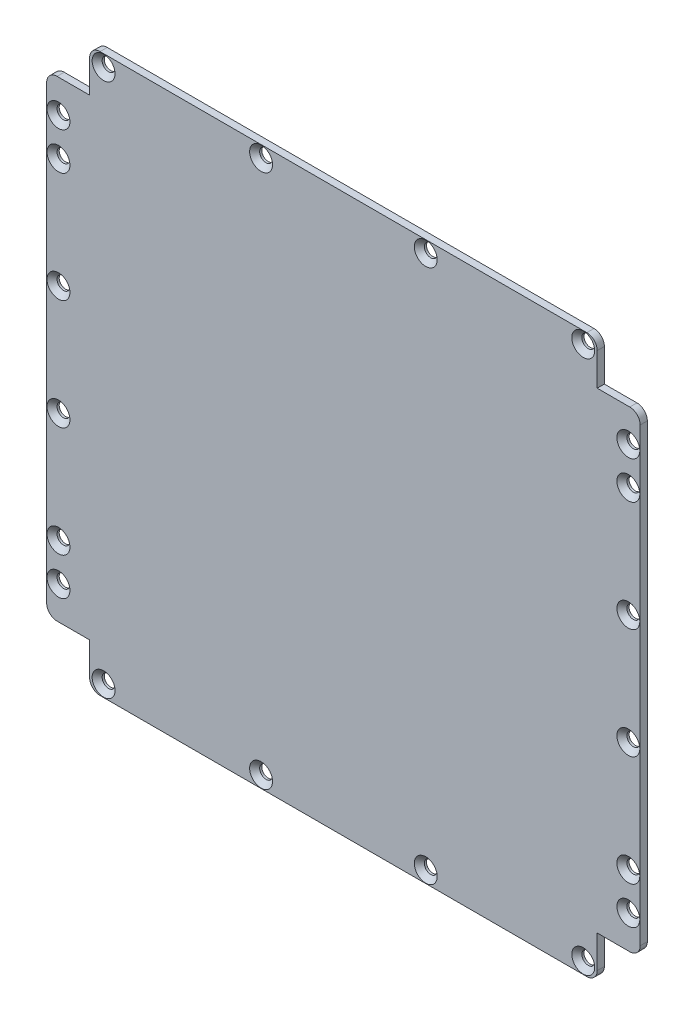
SolidWorks part; units mm, degrees
ref_plane "前视" through (0, 0, 0) normal (0, 0, 1) x (1, 0, 0)
ref_plane "上视" through (0, 0, 0) normal (0, 1, 0) x (1, 0, 0)
ref_plane "右视" through (0, 0, 0) normal (1, 0, 0) x (0, 0, -1)
sketch "草图1" plane through (0, 0, 0) normal (0, 0, 1) x (1, 0, 0)
  line L0 (100.0701, 138.3777) -> (98.0701, 138.3777)
  line L1 (98.0701, 125.6777) -> (100.0701, 125.6777)
  line L2 (98.0701, 134.1277) -> (93.0701, 134.1277)
  line L3 (93.0701, 129.9277) -> (98.0701, 129.9277)
  line L4 (187.0701, 122.3777) -> (185.0701, 122.3777)
  line L5 (185.0701, 109.6777) -> (187.0701, 109.6777)
  line L6 (187.0701, 113.9277) -> (192.0701, 113.9277)
  line L7 (192.0701, 118.1277) -> (187.0701, 118.1277)
  line L8 (100.0701, 109.3777) -> (98.0701, 109.3777)
  line L9 (98.0701, 96.6777) -> (100.0701, 96.6777)
  line L10 (98.0701, 105.1277) -> (93.0701, 105.1277)
  line L11 (93.0701, 100.9277) -> (98.0701, 100.9277)
  line L12 (187.0701, 109.3777) -> (185.0701, 109.3777)
  line L13 (185.0701, 96.6777) -> (187.0701, 96.6777)
  line L14 (187.0701, 100.9277) -> (192.0701, 100.9277)
  line L15 (192.0701, 105.1277) -> (187.0701, 105.1277)
  line L16 (187.0701, 138.3777) -> (185.0701, 138.3777)
  line L17 (185.0701, 125.6777) -> (187.0701, 125.6777)
  line L18 (187.0701, 129.9277) -> (192.0701, 129.9277)
  line L19 (192.0701, 134.1277) -> (187.0701, 134.1277)
  line L20 (172.2601, 70.7177) -> (172.2601, 75.6677)
  line L21 (158.5201, 75.6677) -> (158.5201, 70.7177)
  line L22 (98.0701, 137.7022) -> (100.0701, 137.7022)
  line L23 (98.0701, 137.7022) -> (98.0701, 138.3777)
  line L24 (100.0701, 126.3532) -> (98.0701, 126.3532)
  line L25 (98.0701, 125.6777) -> (98.0701, 126.3532)
  line L26 (98.0701, 126.3532) -> (98.0701, 137.7022)
  line L27 (93.0701, 134.1277) -> (93.0701, 129.9277)
  line L28 (185.0701, 121.7022) -> (187.0701, 121.7022)
  line L29 (187.0701, 122.3777) -> (187.0701, 121.7022)
  line L30 (187.0701, 110.3532) -> (185.0701, 110.3532)
  line L31 (187.0701, 121.7022) -> (187.0701, 110.3532)
  line L32 (187.0701, 110.3532) -> (187.0701, 109.6777)
  line L33 (192.0701, 116.0277) -> (192.0701, 118.1277)
  line L34 (192.0701, 113.9277) -> (192.0701, 116.0277)
  line L35 (100.0701, 97.3532) -> (98.0701, 97.3532)
  line L36 (98.0701, 97.3532) -> (98.0701, 108.7022)
  line L37 (98.0701, 108.7022) -> (100.0701, 108.7022)
  line L38 (98.0701, 108.7022) -> (98.0701, 109.3777)
  line L39 (98.0701, 96.6777) -> (98.0701, 97.3532)
  line L40 (93.0701, 105.1277) -> (93.0701, 100.9277)
  line L41 (185.0701, 108.7022) -> (187.0701, 108.7022)
  line L42 (187.0701, 108.7022) -> (187.0701, 97.3532)
  line L43 (187.0701, 97.3532) -> (185.0701, 97.3532)
  line L44 (187.0701, 109.3777) -> (187.0701, 108.7022)
  line L45 (187.0701, 97.3532) -> (187.0701, 96.6777)
  line L46 (192.0701, 103.0277) -> (192.0701, 105.1277)
  line L47 (192.0701, 100.9277) -> (192.0701, 103.0277)
  line L48 (185.0701, 137.7022) -> (187.0701, 137.7022)
  line L49 (187.0701, 138.3777) -> (187.0701, 137.7022)
  line L50 (187.0701, 126.3532) -> (185.0701, 126.3532)
  line L51 (187.0701, 126.3532) -> (187.0701, 125.6777)
  line L52 (187.0701, 137.7022) -> (187.0701, 126.3532)
  line L53 (192.0701, 132.0277) -> (192.0701, 134.1277)
  line L54 (192.0701, 129.9277) -> (192.0701, 132.0277)
  line L55 (155.7101, 75.6677) -> (175.0701, 75.6677)
  line L56 (155.7101, 75.6677) -> (155.7101, 78.0277)
  line L57 (175.0701, 78.0277) -> (175.0701, 75.6677)
  line L58 (153.7101, 78.0277) -> (153.7101, 75.6677)
  line L59 (153.7101, 75.6677) -> (155.7101, 75.6677)
  line L60 (177.0701, 75.6677) -> (177.0701, 78.0277)
  line L61 (175.0701, 75.6677) -> (177.0701, 75.6677)
  line L62 (169.7601, 70.7177) -> (172.2601, 70.7177)
  line L63 (169.7601, 75.6677) -> (169.7601, 70.7177)
  line L64 (161.0201, 70.7177) -> (161.0201, 75.6677)
  line L65 (158.5201, 70.7177) -> (161.0201, 70.7177)
  line L66 (169.7601, 70.7177) -> (161.0201, 70.7177)
  line L67 (155.3001, 71.2542) -> (155.3001, 75.6677)
  line L68 (157.3201, 71.2542) -> (157.3201, 75.6677)
  line L69 (154.2901, 71.7677) -> (154.5354, 71.7677)
  line L70 (154.2901, 75.6677) -> (154.2901, 71.7677)
  line L71 (154.5354, 70.9754) -> (154.7951, 70.8677)
  line L72 (154.5354, 71.7677) -> (154.5354, 70.9754)
  line L73 (157.8251, 70.8677) -> (158.0847, 70.9754)
  line L74 (158.3301, 71.7677) -> (158.3301, 75.6677)
  line L75 (158.0847, 71.7677) -> (158.3301, 71.7677)
  line L76 (158.0847, 70.9754) -> (158.0847, 71.7677)
  line L77 (157.8251, 70.8677) -> (156.3101, 70.8677)
  line L78 (156.3101, 70.8677) -> (154.7951, 70.8677)
  line L79 (158.007, 70.8677) -> (158.0847, 70.9754)
  line L80 (157.8251, 70.8677) -> (158.007, 70.8677)
  line L81 (154.5354, 70.9754) -> (154.6131, 70.8677)
  line L82 (154.6131, 70.8677) -> (154.7951, 70.8677)
  line L83 (172.4501, 71.7677) -> (172.6954, 71.7677)
  line L84 (172.4501, 75.6677) -> (172.4501, 71.7677)
  line L85 (173.4601, 71.2542) -> (173.4601, 75.6677)
  line L86 (172.6954, 70.9754) -> (172.9551, 70.8677)
  line L87 (172.6954, 71.7677) -> (172.6954, 70.9754)
  line L88 (175.9851, 70.8677) -> (176.2447, 70.9754)
  line L89 (175.4801, 71.2542) -> (175.4801, 75.6677)
  line L90 (176.4901, 71.7677) -> (176.4901, 75.6677)
  line L91 (176.2447, 71.7677) -> (176.4901, 71.7677)
  line L92 (176.2447, 70.9754) -> (176.2447, 71.7677)
  line L93 (175.9851, 70.8677) -> (174.4701, 70.8677)
  line L94 (174.4701, 70.8677) -> (172.9551, 70.8677)
  line L95 (176.167, 70.8677) -> (176.2447, 70.9754)
  line L96 (175.9851, 70.8677) -> (176.167, 70.8677)
  line L97 (172.6954, 70.9754) -> (172.7731, 70.8677)
  line L98 (172.7731, 70.8677) -> (172.9551, 70.8677)
  line L99 (179.0701, 158.0277) -> (106.0701, 158.0277)
  line L100 (100.0701, 152.0277) -> (100.0701, 84.0277)
  line L101 (185.0701, 84.0277) -> (181.5701, 84.0277)
  line L102 (106.0701, 78.0277) -> (179.0701, 78.0277)
  line L103 (106.0701, 78.0277) -> (106.0701, 81.5277)
  line L104 (181.5701, 152.0277) -> (185.0701, 152.0277)
  line L105 (179.0701, 78.0277) -> (179.0701, 81.5277)
  line L106 (100.0701, 152.0277) -> (103.5701, 152.0277)
  line L107 (185.0701, 84.0277) -> (185.0701, 152.0277)
  line L108 (103.5701, 84.0277) -> (100.0701, 84.0277)
  line L109 (106.0701, 154.5277) -> (106.0701, 158.0277)
  line L110 (179.0701, 158.0277) -> (179.0701, 154.5277)
  line L111 (185.0701, 158.0277) -> (179.0701, 158.0277)
  line L112 (185.0701, 152.0277) -> (185.0701, 158.0277)
  line L113 (179.0701, 78.0277) -> (185.0701, 78.0277)
  line L114 (185.0701, 78.0277) -> (185.0701, 84.0277)
  line L115 (100.0701, 84.0277) -> (100.0701, 78.0277)
  line L116 (100.0701, 78.0277) -> (106.0701, 78.0277)
  line L117 (106.0701, 158.0277) -> (100.0701, 158.0277)
  line L118 (100.0701, 158.0277) -> (100.0701, 152.0277)
  line L119 (47.0263, 121.7022) -> (47.0263, 110.3532)
  line L120 (52.7263, 110.3532) -> (52.7263, 121.7022)
  line L121 (47.0263, 108.7022) -> (47.0263, 97.3532)
  line L122 (52.7263, 97.3532) -> (52.7263, 108.7022)
  line L123 (47.0263, 137.7022) -> (47.0263, 126.3532)
  line L124 (52.7263, 126.3532) -> (52.7263, 137.7022)
  line L125 (55.7763, 75.6677) -> (55.7763, 78.0277)
  line L126 (53.7763, 75.6677) -> (55.7763, 75.6677)
  line L127 (53.7763, 78.0277) -> (53.7763, 75.6677)
  line L128 (50.1763, 75.6677) -> (50.1763, 78.0277)
  line L129 (50.1763, 75.6677) -> (53.7763, 75.6677)
  line L130 (48.1763, 78.0277) -> (48.1763, 75.6677)
  line L131 (48.1763, 75.6677) -> (50.1763, 75.6677)
  line L132 (48.8763, 75.6677) -> (48.8763, 70.7177)
  line L133 (48.8763, 70.7177) -> (52.6263, 70.7177)
  line L134 (53.8263, 75.6677) -> (53.8263, 70.7177)
  line L135 (52.6263, 70.7177) -> (53.8263, 70.7177)
  line L136 (55.0763, 70.7177) -> (55.0763, 75.6677)
  line L137 (53.8263, 70.7177) -> (55.0763, 70.7177)
  line L138 (51.9763, 71.7677) -> (52.4013, 71.7677)
  line L139 (51.9763, 71.7677) -> (51.9763, 75.6677)
  line L140 (53.7256, 71.2542) -> (53.7256, 75.6677)
  line L141 (52.4013, 70.9754) -> (52.851, 70.8677)
  line L142 (52.4013, 71.7677) -> (52.4013, 70.9754)
  line L143 (51.1016, 70.8677) -> (51.5513, 70.9754)
  line L144 (50.2269, 71.2542) -> (50.2269, 75.6677)
  line L145 (51.5513, 71.7677) -> (51.9763, 71.7677)
  line L146 (51.5513, 70.9754) -> (51.5513, 71.7677)
  line L147 (51.1016, 70.8677) -> (51.5513, 70.8677)
  line L148 (51.5513, 70.8677) -> (51.5513, 70.9754)
  line L149 (52.851, 70.8677) -> (52.4013, 70.8677)
  line L150 (52.4013, 70.9754) -> (52.4013, 70.8677)
  line L151 (53.7256, 70.8677) -> (52.851, 70.8677)
  line L152 (51.1016, 70.8677) -> (50.2269, 70.8677)
  line L153 (60.1763, 152.0277) -> (60.1763, 158.0277)
  line L154 (60.1763, 158.0277) -> (64.1763, 158.0277)
  line L155 (64.1763, 158.0277) -> (64.1763, 78.0277)
  line L156 (60.1763, 78.0277) -> (64.1763, 78.0277)
  line L157 (60.1763, 78.0277) -> (60.1763, 84.0277)
  line L158 (60.1763, 84.0277) -> (45.1763, 84.0277)
  line L159 (45.1763, 84.0277) -> (45.1763, 152.0277)
  line L160 (45.1763, 152.0277) -> (60.1763, 152.0277)
  line L161 (45.1763, 81.5277) -> (60.1763, 81.5277)
  line L162 (45.1763, 84.0277) -> (45.1763, 81.5277)
  line L163 (60.1763, 154.5277) -> (45.1763, 154.5277)
  line L164 (45.1763, 154.5277) -> (45.1763, 152.0277)
  line L165 (45.1763, 158.0277) -> (45.1763, 154.5277)
  line L166 (60.1763, 158.0277) -> (45.1763, 158.0277)
  line L167 (45.1763, 78.0277) -> (45.1763, 81.5277)
  line L168 (45.1763, 78.0277) -> (60.1763, 78.0277)
  line L169 (52.6263, 70.7177) -> (52.6263, 70.8677)
  line L170 (245.9633, 126.3532) -> (245.9633, 137.7022)
  line L171 (240.2633, 137.7022) -> (240.2633, 126.3532)
  line L172 (240.2633, 108.7022) -> (240.2633, 97.3532)
  line L173 (245.9633, 97.3532) -> (245.9633, 108.7022)
  line L174 (239.2133, 75.6677) -> (239.2133, 78.0277)
  line L175 (237.2133, 75.6677) -> (239.2133, 75.6677)
  line L176 (237.2133, 78.0277) -> (237.2133, 75.6677)
  line L177 (242.8133, 78.0277) -> (242.8133, 75.6677)
  line L178 (239.2133, 75.6677) -> (242.8133, 75.6677)
  line L179 (244.8133, 75.6677) -> (244.8133, 78.0277)
  line L180 (242.8133, 75.6677) -> (244.8133, 75.6677)
  line L181 (244.1133, 70.7177) -> (244.1133, 75.6677)
  line L182 (240.3633, 70.7177) -> (244.1133, 70.7177)
  line L183 (239.1633, 70.7177) -> (239.1633, 75.6677)
  line L184 (239.1633, 70.7177) -> (240.3633, 70.7177)
  line L185 (237.9133, 75.6677) -> (237.9133, 70.7177)
  line L186 (237.9133, 70.7177) -> (239.1633, 70.7177)
  line L187 (240.1386, 70.8677) -> (240.5883, 70.9754)
  line L188 (239.2639, 71.2542) -> (239.2639, 75.6677)
  line L189 (241.0133, 75.6677) -> (241.0133, 71.7677)
  line L190 (240.5883, 71.7677) -> (241.0133, 71.7677)
  line L191 (240.5883, 70.9754) -> (240.5883, 71.7677)
  line L192 (242.7626, 71.2542) -> (242.7626, 75.6677)
  line L193 (241.4383, 70.9754) -> (241.8879, 70.8677)
  line L194 (241.4383, 71.7677) -> (241.4383, 70.9754)
  line L195 (241.0133, 71.7677) -> (241.4383, 71.7677)
  line L196 (240.1386, 70.8677) -> (240.5883, 70.8677)
  line L197 (240.5883, 70.8677) -> (240.5883, 70.9754)
  line L198 (241.4383, 70.8677) -> (241.8879, 70.8677)
  line L199 (241.4383, 70.9754) -> (241.4383, 70.8677)
  line L200 (239.2639, 70.8677) -> (240.1386, 70.8677)
  line L201 (242.7626, 70.8677) -> (241.8879, 70.8677)
  line L202 (232.8133, 84.0277) -> (232.8133, 78.0277)
  line L203 (228.8133, 78.0277) -> (232.8133, 78.0277)
  line L204 (228.8133, 78.0277) -> (228.8133, 158.0277)
  line L205 (232.8133, 158.0277) -> (228.8133, 158.0277)
  line L206 (232.8133, 158.0277) -> (232.8133, 152.0277)
  line L207 (232.8133, 152.0277) -> (247.8133, 152.0277)
  line L208 (247.8133, 152.0277) -> (247.8133, 84.0277)
  line L209 (247.8133, 84.0277) -> (232.8133, 84.0277)
  line L210 (247.8133, 154.5277) -> (232.8133, 154.5277)
  line L211 (247.8133, 152.0277) -> (247.8133, 154.5277)
  line L212 (232.8133, 81.5277) -> (247.8133, 81.5277)
  line L213 (247.8133, 81.5277) -> (247.8133, 84.0277)
  line L214 (247.8133, 154.5277) -> (247.8133, 158.0277)
  line L215 (247.8133, 158.0277) -> (232.8133, 158.0277)
  line L216 (247.8133, 78.0277) -> (247.8133, 81.5277)
  line L217 (232.8133, 78.0277) -> (247.8133, 78.0277)
  line L218 (240.3633, 70.8677) -> (240.3633, 70.7177)
  line L219 (98.0701, 192.1775) -> (93.0701, 192.1775)
  line L220 (93.0701, 187.9775) -> (98.0701, 187.9775)
  line L221 (187.0701, 187.9775) -> (192.0701, 187.9775)
  line L222 (192.0701, 192.1775) -> (187.0701, 192.1775)
  line L223 (100.0701, 192.9275) -> (98.0701, 192.9275)
  line L224 (98.0701, 187.2275) -> (100.0701, 187.2275)
  line L225 (98.0701, 187.2275) -> (98.0701, 192.9275)
  line L226 (93.0701, 192.1775) -> (93.0701, 187.9775)
  line L227 (185.0701, 187.2275) -> (187.0701, 187.2275)
  line L228 (187.0701, 192.9275) -> (185.0701, 192.9275)
  line L229 (187.0701, 192.9275) -> (187.0701, 187.2275)
  line L230 (192.0701, 187.9775) -> (192.0701, 192.1775)
  line L231 (169.7601, 191.0775) -> (161.0201, 191.0775)
  line L232 (169.7601, 190.5775) -> (161.0201, 190.5775)
  line L233 (159.288, 187.5775) -> (159.9808, 186.3775)
  line L234 (161.7129, 185.3775) -> (169.0673, 185.3775)
  line L235 (170.7993, 186.3775) -> (171.4921, 187.5775)
  line L236 (171.9251, 187.3275) -> (171.2323, 186.1275)
  line L237 (159.5478, 186.1275) -> (158.855, 187.3275)
  line L238 (161.7129, 184.8775) -> (169.0673, 184.8775)
  line L239 (153.7101, 186.1775) -> (153.7101, 189.7775)
  line L240 (155.7101, 191.7775) -> (175.0701, 191.7775)
  line L241 (177.0701, 189.7775) -> (177.0701, 186.1775)
  line L242 (175.0701, 184.1775) -> (155.7101, 184.1775)
  line L243 (158.007, 188.4025) -> (158.0847, 188.4025)
  line L244 (157.8251, 188.8522) -> (158.0847, 188.4025)
  line L245 (154.6131, 187.5525) -> (154.5354, 187.5525)
  line L246 (154.7951, 187.1028) -> (154.5354, 187.5525)
  line L247 (158.007, 187.5525) -> (156.9878, 187.5525)
  line L248 (155.6323, 187.5525) -> (154.6131, 187.5525)
  line L249 (156.9878, 188.4025) -> (158.007, 188.4025)
  line L250 (154.6131, 188.4025) -> (155.6323, 188.4025)
  line L251 (154.5354, 188.4025) -> (154.6131, 188.4025)
  line L252 (154.5354, 188.4025) -> (154.7951, 188.8522)
  line L253 (158.0847, 187.5525) -> (158.007, 187.5525)
  line L254 (158.0847, 187.5525) -> (157.8251, 187.1028)
  line L255 (158.3301, 187.9775) -> (158.0847, 187.5525)
  line L256 (158.0847, 188.4025) -> (158.3301, 187.9775)
  line L257 (154.2901, 187.9775) -> (154.5354, 188.4025)
  line L258 (154.5354, 187.5525) -> (154.2901, 187.9775)
  line L259 (176.167, 188.4025) -> (176.2447, 188.4025)
  line L260 (175.9851, 188.8522) -> (176.2447, 188.4025)
  line L261 (172.7731, 187.5525) -> (172.6954, 187.5525)
  line L262 (172.9551, 187.1028) -> (172.6954, 187.5525)
  line L263 (176.167, 187.5525) -> (175.1478, 187.5525)
  line L264 (173.7923, 187.5525) -> (172.7731, 187.5525)
  line L265 (175.1478, 188.4025) -> (176.167, 188.4025)
  line L266 (172.7731, 188.4025) -> (173.7923, 188.4025)
  line L267 (172.6954, 188.4025) -> (172.7731, 188.4025)
  line L268 (172.6954, 188.4025) -> (172.9551, 188.8522)
  line L269 (176.2447, 187.5525) -> (176.167, 187.5525)
  line L270 (176.2447, 187.5525) -> (175.9851, 187.1028)
  line L271 (176.4901, 187.9775) -> (176.2447, 187.5525)
  line L272 (176.2447, 188.4025) -> (176.4901, 187.9775)
  line L273 (172.4501, 187.9775) -> (172.6954, 188.4025)
  line L274 (172.6954, 187.5525) -> (172.4501, 187.9775)
  line L275 (179.0701, 179.7775) -> (185.0701, 179.7775)
  line L276 (185.0701, 179.7775) -> (185.0701, 175.7775)
  line L277 (185.0701, 175.7775) -> (100.0701, 175.7775)
  line L278 (100.0701, 175.7775) -> (100.0701, 179.7775)
  line L279 (100.0701, 179.7775) -> (106.0701, 179.7775)
  line L280 (106.0701, 179.7775) -> (106.0701, 194.7775)
  line L281 (106.0701, 194.7775) -> (179.0701, 194.7775)
  line L282 (179.0701, 194.7775) -> (179.0701, 179.7775)
  line L283 (103.5701, 194.7775) -> (103.5701, 179.7775)
  line L284 (106.0701, 194.7775) -> (103.5701, 194.7775)
  line L285 (181.5701, 179.7775) -> (181.5701, 194.7775)
  line L286 (181.5701, 194.7775) -> (179.0701, 194.7775)
  line L287 (103.5701, 194.7775) -> (100.0701, 194.7775)
  line L288 (100.0701, 194.7775) -> (100.0701, 179.7775)
  line L289 (185.0701, 194.7775) -> (181.5701, 194.7775)
  line L290 (185.0701, 179.7775) -> (185.0701, 194.7775)
  line L291 (98.0701, 38.4347) -> (93.0701, 38.4347)
  line L292 (93.0701, 34.2347) -> (98.0701, 34.2347)
  line L293 (187.0701, 34.2347) -> (192.0701, 34.2347)
  line L294 (192.0701, 38.4347) -> (187.0701, 38.4347)
  line L295 (100.0701, 39.1847) -> (98.0701, 39.1847)
  line L296 (98.0701, 33.4847) -> (100.0701, 33.4847)
  line L297 (98.0701, 33.4847) -> (98.0701, 39.1847)
  line L298 (93.0701, 38.4347) -> (93.0701, 34.2347)
  line L299 (185.0701, 33.4847) -> (187.0701, 33.4847)
  line L300 (187.0701, 39.1847) -> (185.0701, 39.1847)
  line L301 (187.0701, 39.1847) -> (187.0701, 33.4847)
  line L302 (192.0701, 34.2347) -> (192.0701, 38.4347)
  line L303 (179.0701, 31.6347) -> (106.0701, 31.6347)
  line L304 (106.0701, 31.6347) -> (106.0701, 46.6347)
  line L305 (106.0701, 46.6347) -> (100.0701, 46.6347)
  line L306 (100.0701, 46.6347) -> (100.0701, 50.6347)
  line L307 (100.0701, 50.6347) -> (185.0701, 50.6347)
  line L308 (185.0701, 46.6347) -> (185.0701, 50.6347)
  line L309 (185.0701, 46.6347) -> (179.0701, 46.6347)
  line L310 (179.0701, 46.6347) -> (179.0701, 31.6347)
  line L311 (181.5701, 31.6347) -> (181.5701, 46.6347)
  line L312 (179.0701, 31.6347) -> (181.5701, 31.6347)
  line L313 (103.5701, 46.6347) -> (103.5701, 31.6347)
  line L314 (103.5701, 31.6347) -> (106.0701, 31.6347)
  line L315 (181.5701, 31.6347) -> (185.0701, 31.6347)
  line L316 (185.0701, 31.6347) -> (185.0701, 46.6347)
  line L317 (100.0701, 31.6347) -> (103.5701, 31.6347)
  line L318 (100.0701, 46.6347) -> (100.0701, 31.6347)
  line L319 (362.8161, 138.3777) -> (360.8161, 138.3777)
  line L320 (360.8161, 125.6777) -> (362.8161, 125.6777)
  line L321 (362.8161, 129.9277) -> (367.8161, 129.9277)
  line L322 (367.8161, 134.1277) -> (362.8161, 134.1277)
  line L323 (275.8161, 122.3777) -> (273.8161, 122.3777)
  line L324 (273.8161, 109.6777) -> (275.8161, 109.6777)
  line L325 (273.8161, 118.1277) -> (268.8161, 118.1277)
  line L326 (268.8161, 113.9277) -> (273.8161, 113.9277)
  line L327 (362.8161, 109.3777) -> (360.8161, 109.3777)
  line L328 (360.8161, 96.6777) -> (362.8161, 96.6777)
  line L329 (362.8161, 100.9277) -> (367.8161, 100.9277)
  line L330 (367.8161, 105.1277) -> (362.8161, 105.1277)
  line L331 (275.8161, 109.3777) -> (273.8161, 109.3777)
  line L332 (273.8161, 96.6777) -> (275.8161, 96.6777)
  line L333 (273.8161, 105.1277) -> (268.8161, 105.1277)
  line L334 (268.8161, 100.9277) -> (273.8161, 100.9277)
  line L335 (273.8161, 125.6777) -> (275.8161, 125.6777)
  line L336 (275.8161, 138.3777) -> (273.8161, 138.3777)
  line L337 (273.8161, 134.1277) -> (268.8161, 134.1277)
  line L338 (268.8161, 129.9277) -> (273.8161, 129.9277)
  line L339 (302.3661, 70.7177) -> (302.3661, 75.6677)
  line L340 (288.6261, 75.6677) -> (288.6261, 70.7177)
  line L341 (360.8161, 137.7022) -> (362.8161, 137.7022)
  line L342 (362.8161, 138.3777) -> (362.8161, 137.7022)
  line L343 (362.8161, 126.3532) -> (360.8161, 126.3532)
  line L344 (362.8161, 137.7022) -> (362.8161, 126.3532)
  line L345 (362.8161, 126.3532) -> (362.8161, 125.6777)
  line L346 (367.8161, 132.0277) -> (367.8161, 134.1277)
  line L347 (367.8161, 129.9277) -> (367.8161, 132.0277)
  line L348 (273.8161, 121.7022) -> (275.8161, 121.7022)
  line L349 (273.8161, 121.7022) -> (273.8161, 122.3777)
  line L350 (275.8161, 110.3532) -> (273.8161, 110.3532)
  line L351 (273.8161, 109.6777) -> (273.8161, 110.3532)
  line L352 (273.8161, 110.3532) -> (273.8161, 121.7022)
  line L353 (268.8161, 118.1277) -> (268.8161, 113.9277)
  line L354 (360.8161, 108.7022) -> (362.8161, 108.7022)
  line L355 (362.8161, 109.3777) -> (362.8161, 108.7022)
  line L356 (362.8161, 97.3532) -> (360.8161, 97.3532)
  line L357 (362.8161, 108.7022) -> (362.8161, 97.3532)
  line L358 (362.8161, 97.3532) -> (362.8161, 96.6777)
  line L359 (367.8161, 103.0277) -> (367.8161, 105.1277)
  line L360 (367.8161, 100.9277) -> (367.8161, 103.0277)
  line L361 (273.8161, 108.7022) -> (275.8161, 108.7022)
  line L362 (273.8161, 108.7022) -> (273.8161, 109.3777)
  line L363 (275.8161, 97.3532) -> (273.8161, 97.3532)
  line L364 (273.8161, 97.3532) -> (273.8161, 108.7022)
  line L365 (273.8161, 96.6777) -> (273.8161, 97.3532)
  line L366 (268.8161, 105.1277) -> (268.8161, 100.9277)
  line L367 (275.8161, 126.3532) -> (273.8161, 126.3532)
  line L368 (273.8161, 125.6777) -> (273.8161, 126.3532)
  line L369 (273.8161, 137.7022) -> (275.8161, 137.7022)
  line L370 (273.8161, 137.7022) -> (273.8161, 138.3777)
  line L371 (273.8161, 126.3532) -> (273.8161, 137.7022)
  line L372 (268.8161, 134.1277) -> (268.8161, 129.9277)
  line L373 (285.8161, 75.6677) -> (285.8161, 78.0277)
  line L374 (305.1761, 78.0277) -> (305.1761, 75.6677)
  line L375 (285.8161, 75.6677) -> (305.1761, 75.6677)
  line L376 (283.8161, 78.0277) -> (283.8161, 75.6677)
  line L377 (283.8161, 75.6677) -> (285.8161, 75.6677)
  line L378 (307.1761, 75.6677) -> (307.1761, 78.0277)
  line L379 (305.1761, 75.6677) -> (307.1761, 75.6677)
  line L380 (291.8189, 70.7177) -> (291.8189, 75.6677)
  line L381 (299.1733, 75.6677) -> (299.1733, 70.7177)
  line L382 (299.1733, 70.7177) -> (291.8189, 70.7177)
  line L383 (301.3384, 70.7177) -> (301.3384, 75.6677)
  line L384 (299.1733, 70.7177) -> (301.3384, 70.7177)
  line L385 (289.6539, 75.6677) -> (289.6539, 70.7177)
  line L386 (289.6539, 70.7177) -> (291.8189, 70.7177)
  line L387 (302.0312, 75.6677) -> (302.0312, 70.7177)
  line L388 (301.3384, 70.7177) -> (302.0312, 70.7177)
  line L389 (288.9611, 70.7177) -> (288.9611, 75.6677)
  line L390 (288.9611, 70.7177) -> (289.6539, 70.7177)
  line L391 (302.0312, 70.7177) -> (302.3661, 70.7177)
  line L392 (288.6261, 70.7177) -> (288.9611, 70.7177)
  line L393 (306.0911, 70.8677) -> (306.3508, 70.9754)
  line L394 (305.5861, 71.2542) -> (305.5861, 75.6677)
  line L395 (306.5961, 75.6677) -> (306.5961, 71.7677)
  line L396 (306.3508, 71.7677) -> (306.5961, 71.7677)
  line L397 (306.3508, 70.9754) -> (306.3508, 71.7677)
  line L398 (302.5561, 71.7677) -> (302.8015, 71.7677)
  line L399 (302.5561, 71.7677) -> (302.5561, 75.6677)
  line L400 (303.5661, 71.2542) -> (303.5661, 75.6677)
  line L401 (302.8015, 70.9754) -> (303.0611, 70.8677)
  line L402 (302.8015, 71.7677) -> (302.8015, 70.9754)
  line L403 (304.5761, 70.8677) -> (306.0911, 70.8677)
  line L404 (304.5761, 70.8677) -> (303.0611, 70.8677)
  line L405 (306.2731, 70.8677) -> (306.3508, 70.9754)
  line L406 (306.0911, 70.8677) -> (306.2731, 70.8677)
  line L407 (302.8015, 70.9754) -> (302.8792, 70.8677)
  line L408 (303.0611, 70.8677) -> (302.8792, 70.8677)
  line L409 (285.4061, 71.2542) -> (285.4061, 75.6677)
  line L410 (287.4261, 71.2542) -> (287.4261, 75.6677)
  line L411 (287.9311, 70.8677) -> (288.1908, 70.9754)
  line L412 (288.4361, 75.6677) -> (288.4361, 71.7677)
  line L413 (288.1908, 71.7677) -> (288.4361, 71.7677)
  line L414 (288.1908, 70.9754) -> (288.1908, 71.7677)
  line L415 (284.3961, 71.7677) -> (284.6415, 71.7677)
  line L416 (284.3961, 71.7677) -> (284.3961, 75.6677)
  line L417 (284.6415, 70.9754) -> (284.9011, 70.8677)
  line L418 (284.6415, 71.7677) -> (284.6415, 70.9754)
  line L419 (286.4161, 70.8677) -> (287.9311, 70.8677)
  line L420 (286.4161, 70.8677) -> (284.9011, 70.8677)
  line L421 (288.1131, 70.8677) -> (288.1908, 70.9754)
  line L422 (287.9311, 70.8677) -> (288.1131, 70.8677)
  line L423 (284.6415, 70.9754) -> (284.7192, 70.8677)
  line L424 (284.9011, 70.8677) -> (284.7192, 70.8677)
  line L425 (360.8161, 158.0277) -> (275.8161, 158.0277)
  line L426 (360.8161, 78.0277) -> (360.8161, 158.0277)
  line L427 (275.8161, 78.0277) -> (360.8161, 78.0277)
  line L428 (275.8161, 158.0277) -> (275.8161, 78.0277)
  line L429 (275.8161, 158.0277) -> (275.8161, 78.0277)
  line L430 (360.8161, 158.0277) -> (275.8161, 158.0277)
  line L431 (352.3161, 157.0277) -> (284.3161, 157.0277)
  line L432 (351.3161, 154.0277) -> (285.3161, 154.0277)
  line L433 (358.3161, 151.0277) -> (353.8161, 151.0277)
  line L434 (354.1161, 150.0277) -> (352.8161, 150.0277)
  line L435 (275.8161, 78.0277) -> (360.8161, 78.0277)
  line L436 (284.3161, 79.0277) -> (352.3161, 79.0277)
  line L437 (287.6161, 82.0277) -> (349.0161, 82.0277)
  line L438 (359.8161, 143.2277) -> (359.8161, 149.5277)
  line L439 (353.8161, 151.0277) -> (353.8161, 155.5277)
  line L440 (352.8161, 150.0277) -> (352.8161, 152.5277)
  line L441 (276.8161, 143.2277) -> (276.8161, 149.5277)
  line L442 (359.8161, 92.8277) -> (359.8161, 86.5277)
  line L443 (276.8161, 92.8277) -> (276.8161, 86.5277)
  line L444 (278.3161, 151.0277) -> (282.8161, 151.0277)
  line L445 (282.5161, 150.0277) -> (283.8161, 150.0277)
  line L446 (282.8161, 151.0277) -> (282.8161, 155.5277)
  line L447 (283.8161, 150.0277) -> (283.8161, 152.5277)
  line L448 (358.3161, 85.0277) -> (353.8161, 85.0277)
  line L449 (354.1161, 86.0277) -> (352.8161, 86.0277)
  line L450 (353.8161, 85.0277) -> (353.8161, 80.5277)
  line L451 (352.8161, 86.0277) -> (352.8161, 83.5277)
  line L452 (278.3161, 85.0277) -> (282.8161, 85.0277)
  line L453 (283.0161, 86.0277) -> (283.8161, 86.0277)
  line L454 (282.8161, 85.0277) -> (282.8161, 80.5277)
  line L455 (283.8161, 86.0277) -> (283.8161, 83.5277)
  line L456 (307.3161, 78.0277) -> (283.8161, 78.0277)
  line L457 (278.0161, 143.2277) -> (275.8161, 143.2277)
  line L458 (278.0161, 92.8277) -> (275.8161, 92.8277)
  line L459 (358.6161, 92.8277) -> (360.8161, 92.8277)
  line L460 (358.6161, 143.2277) -> (360.8161, 143.2277)
  line L461 (285.6161, 95.8277) -> (285.6161, 84.0277)
  line L462 (281.0161, 95.8277) -> (281.0161, 92.8277)
  line L463 (283.0161, 97.8277) -> (283.6161, 97.8277)
  line L464 (351.0161, 95.8277) -> (351.0161, 84.0277)
  line L465 (353.6161, 97.8277) -> (353.0161, 97.8277)
  line L466 (287.6161, 82.0277) -> (285.3161, 82.0277)
  line L467 (282.5161, 86.0277) -> (283.0161, 86.0277)
  line L468 (351.3161, 82.0277) -> (349.0161, 82.0277)
  line L469 (285.6161, 140.2277) -> (285.6161, 152.0277)
  line L470 (283.0161, 138.2277) -> (283.6161, 138.2277)
  line L471 (351.0161, 140.2277) -> (351.0161, 152.0277)
  line L472 (353.6161, 138.2277) -> (353.0161, 138.2277)
  line L473 (355.6161, 95.8277) -> (355.6161, 92.8277)
  line L474 (281.0161, 140.2277) -> (281.0161, 143.2277)
  line L475 (355.6161, 140.2277) -> (355.6161, 143.2277)
  line L476 (281.0161, 143.2277) -> (281.0161, 148.5277)
  line L477 (355.6161, 143.2288) -> (355.6161, 148.5277)
  line L478 (355.6161, 93.0277) -> (355.6161, 87.5277)
  line L479 (281.0161, 92.8277) -> (281.0161, 87.5277)
  line L480 (360.8161, 158.0277) -> (360.8161, 78.0277)
  line L481 (477.7232, 151.3741) -> (477.7232, 155.9241)
  line L482 (476.2732, 157.3741) -> (408.2732, 157.3741)
  line L483 (406.8232, 155.9241) -> (406.8232, 151.3741)
  line L484 (406.8232, 151.3741) -> (402.2732, 151.3741)
  line L485 (400.8232, 149.9241) -> (400.8232, 86.9241)
  line L486 (402.2732, 85.4741) -> (406.8232, 85.4741)
  line L487 (406.8232, 85.4741) -> (406.8232, 80.9241)
  line L488 (408.2732, 79.4741) -> (476.2732, 79.4741)
  line L489 (477.7232, 80.9241) -> (477.7232, 85.4741)
  line L490 (477.7232, 85.4741) -> (482.2732, 85.4741)
  line L491 (483.7232, 86.9241) -> (483.7232, 149.9241)
  line L492 (482.2732, 151.3741) -> (477.7232, 151.3741)
  arc A0 (181.5701, 84.0277) -> (179.0701, 81.5277) centre (181.5701, 81.5277) ccw
  arc A1 (106.0701, 81.5277) -> (103.5701, 84.0277) centre (103.5701, 81.5277) ccw
  arc A2 (103.5701, 152.0277) -> (106.0701, 154.5277) centre (103.5701, 154.5277) ccw
  arc A3 (179.0701, 154.5277) -> (181.5701, 152.0277) centre (181.5701, 154.5277) ccw
  circle A4 centre (182.0701, 155.0277) radius 1.35
  circle A5 centre (182.0701, 81.0277) radius 1.35
  circle A6 centre (103.0701, 81.0277) radius 1.35
  circle A7 centre (103.0701, 155.0277) radius 1.35
  circle A8 centre (49.8763, 116.0277) radius 1.6
  circle A9 centre (49.8763, 116.0277) radius 2.1
  circle A10 centre (49.8763, 116.0277) radius 0.25
  circle A11 centre (49.8763, 111.8777) radius 1.1
  circle A12 centre (49.8763, 120.1777) radius 1.1
  arc A13 (52.7263, 121.7022) -> (47.0263, 121.7022) centre (49.8763, 116.0277) ccw
  arc A14 (47.0263, 110.3532) -> (52.7263, 110.3532) centre (49.8763, 116.0277) ccw
  circle A15 centre (49.8763, 103.0277) radius 1.6
  circle A16 centre (49.8763, 103.0277) radius 2.1
  circle A17 centre (49.8763, 103.0277) radius 0.25
  circle A18 centre (49.8763, 98.8777) radius 1.1
  circle A19 centre (49.8763, 107.1777) radius 1.1
  arc A20 (52.7263, 108.7022) -> (47.0263, 108.7022) centre (49.8763, 103.0277) ccw
  arc A21 (47.0263, 97.3532) -> (52.7263, 97.3532) centre (49.8763, 103.0277) ccw
  circle A22 centre (49.8763, 132.0277) radius 2.1
  circle A23 centre (49.8763, 132.0277) radius 1.6
  circle A24 centre (49.8763, 132.0277) radius 0.25
  circle A25 centre (49.8763, 127.8777) radius 1.1
  circle A26 centre (49.8763, 136.1777) radius 1.1
  arc A27 (52.7263, 137.7022) -> (47.0263, 137.7022) centre (49.8763, 132.0277) ccw
  arc A28 (47.0263, 126.3532) -> (52.7263, 126.3532) centre (49.8763, 132.0277) ccw
  circle A29 centre (49.8763, 107.1777) radius 0.8
  circle A30 centre (49.8763, 98.8777) radius 0.8
  circle A31 centre (49.8763, 120.1777) radius 0.8
  circle A32 centre (49.8763, 111.8777) radius 0.8
  circle A33 centre (49.8763, 136.1777) radius 0.8
  circle A34 centre (49.8763, 127.8777) radius 0.8
  circle A35 centre (243.1133, 132.0277) radius 2.1
  circle A36 centre (243.1133, 132.0277) radius 1.6
  circle A37 centre (243.1133, 132.0277) radius 0.25
  circle A38 centre (243.1133, 127.8777) radius 1.1
  circle A39 centre (243.1133, 136.1777) radius 1.1
  arc A40 (240.2633, 126.3532) -> (245.9633, 126.3532) centre (243.1133, 132.0277) ccw
  arc A41 (245.9633, 137.7022) -> (240.2633, 137.7022) centre (243.1133, 132.0277) ccw
  circle A42 centre (243.1133, 103.0277) radius 2.1
  circle A43 centre (243.1133, 103.0277) radius 1.6
  circle A44 centre (243.1133, 103.0277) radius 0.25
  circle A45 centre (243.1133, 98.8777) radius 1.1
  circle A46 centre (243.1133, 107.1777) radius 1.1
  arc A47 (240.2633, 97.3532) -> (245.9633, 97.3532) centre (243.1133, 103.0277) ccw
  arc A48 (245.9633, 108.7022) -> (240.2633, 108.7022) centre (243.1133, 103.0277) ccw
  circle A49 centre (243.1133, 107.1777) radius 0.8
  circle A50 centre (243.1133, 98.8777) radius 0.8
  circle A51 centre (243.1133, 136.1777) radius 0.8
  circle A52 centre (243.1133, 127.8777) radius 0.8
  arc A53 (171.9251, 187.3275) -> (169.7601, 191.0775) centre (169.7601, 188.5775) ccw
  arc A54 (159.5478, 186.1275) -> (161.7129, 184.8775) centre (161.7129, 187.3775) ccw
  arc A55 (161.0201, 191.0775) -> (158.855, 187.3275) centre (161.0201, 188.5775) ccw
  arc A56 (171.4921, 187.5775) -> (169.7601, 190.5775) centre (169.7601, 188.5775) ccw
  arc A57 (161.0201, 190.5775) -> (159.288, 187.5775) centre (161.0201, 188.5775) ccw
  arc A58 (159.9808, 186.3775) -> (161.7129, 185.3775) centre (161.7129, 187.3775) ccw
  arc A59 (169.0673, 184.8775) -> (171.2323, 186.1275) centre (169.0673, 187.3775) ccw
  arc A60 (169.0673, 185.3775) -> (170.7993, 186.3775) centre (169.0673, 187.3775) ccw
  circle A61 centre (161.5801, 186.9775) radius 0.25
  circle A62 centre (161.5801, 186.9775) radius 0.35
  circle A63 centre (162.8501, 186.9775) radius 0.25
  circle A64 centre (162.8501, 186.9775) radius 0.35
  circle A65 centre (164.1201, 186.9775) radius 0.25
  circle A66 centre (164.1201, 186.9775) radius 0.35
  circle A67 centre (165.3901, 186.9775) radius 0.25
  circle A68 centre (165.3901, 186.9775) radius 0.35
  circle A69 centre (166.6601, 186.9775) radius 0.25
  circle A70 centre (166.6601, 186.9775) radius 0.35
  circle A71 centre (167.9301, 186.9775) radius 0.25
  circle A72 centre (167.9301, 186.9775) radius 0.35
  circle A73 centre (169.2001, 186.9775) radius 0.25
  circle A74 centre (169.2001, 186.9775) radius 0.35
  circle A75 centre (169.8351, 188.9775) radius 0.25
  circle A76 centre (169.8351, 188.9775) radius 0.35
  circle A77 centre (166.0251, 188.9775) radius 0.25
  circle A78 centre (166.0251, 188.9775) radius 0.35
  circle A79 centre (167.2951, 188.9775) radius 0.25
  circle A80 centre (167.2951, 188.9775) radius 0.35
  circle A81 centre (168.5651, 188.9775) radius 0.25
  circle A82 centre (168.5651, 188.9775) radius 0.35
  circle A83 centre (160.9451, 188.9775) radius 0.25
  circle A84 centre (160.9451, 188.9775) radius 0.35
  circle A85 centre (162.2151, 188.9775) radius 0.25
  circle A86 centre (162.2151, 188.9775) radius 0.35
  circle A87 centre (163.4851, 188.9775) radius 0.25
  circle A88 centre (163.4851, 188.9775) radius 0.35
  circle A89 centre (164.7551, 188.9775) radius 0.25
  circle A90 centre (164.7551, 188.9775) radius 0.35
  arc A91 (155.7101, 191.7775) -> (153.7101, 189.7775) centre (155.7101, 189.7775) ccw
  arc A92 (177.0701, 189.7775) -> (175.0701, 191.7775) centre (175.0701, 189.7775) ccw
  arc A93 (175.0701, 184.1775) -> (177.0701, 186.1775) centre (175.0701, 186.1775) ccw
  arc A94 (153.7101, 186.1775) -> (155.7101, 184.1775) centre (155.7101, 186.1775) ccw
  arc A95 (158.007, 188.4025) -> (157.8251, 188.8522) centre (156.3101, 187.9775) ccw
  arc A96 (154.6131, 187.5525) -> (154.7951, 187.1028) centre (156.3101, 187.9775) ccw
  arc A97 (154.7951, 187.1028) -> (156.3101, 186.2282) centre (156.3101, 187.9775) ccw
  arc A98 (157.8251, 188.8522) -> (156.3101, 189.7269) centre (156.3101, 187.9775) ccw
  arc A99 (155.6323, 187.5525) -> (156.9878, 187.5525) centre (156.3101, 187.9775) ccw
  arc A100 (157.8251, 187.1028) -> (158.007, 187.5525) centre (156.3101, 187.9775) ccw
  arc A101 (156.3101, 186.2282) -> (157.8251, 187.1028) centre (156.3101, 187.9775) ccw
  arc A102 (154.7951, 188.8522) -> (154.6131, 188.4025) centre (156.3101, 187.9775) ccw
  arc A103 (156.3101, 189.7269) -> (154.7951, 188.8522) centre (156.3101, 187.9775) ccw
  arc A104 (156.9878, 188.4025) -> (155.6323, 188.4025) centre (156.3101, 187.9775) ccw
  arc A105 (156.9878, 187.5525) -> (156.9878, 188.4025) centre (156.3101, 187.9775) ccw
  arc A106 (155.6323, 188.4025) -> (155.6323, 187.5525) centre (156.3101, 187.9775) ccw
  arc A107 (176.167, 188.4025) -> (175.9851, 188.8522) centre (174.4701, 187.9775) ccw
  arc A108 (172.7731, 187.5525) -> (172.9551, 187.1028) centre (174.4701, 187.9775) ccw
  arc A109 (172.9551, 187.1028) -> (174.4701, 186.2282) centre (174.4701, 187.9775) ccw
  arc A110 (175.9851, 188.8522) -> (174.4701, 189.7269) centre (174.4701, 187.9775) ccw
  arc A111 (173.7923, 187.5525) -> (175.1478, 187.5525) centre (174.4701, 187.9775) ccw
  arc A112 (175.9851, 187.1028) -> (176.167, 187.5525) centre (174.4701, 187.9775) ccw
  arc A113 (174.4701, 186.2282) -> (175.9851, 187.1028) centre (174.4701, 187.9775) ccw
  arc A114 (172.9551, 188.8522) -> (172.7731, 188.4025) centre (174.4701, 187.9775) ccw
  arc A115 (174.4701, 189.7269) -> (172.9551, 188.8522) centre (174.4701, 187.9775) ccw
  arc A116 (175.1478, 188.4025) -> (173.7923, 188.4025) centre (174.4701, 187.9775) ccw
  arc A117 (175.1478, 187.5525) -> (175.1478, 188.4025) centre (174.4701, 187.9775) ccw
  arc A118 (173.7923, 188.4025) -> (173.7923, 187.5525) centre (174.4701, 187.9775) ccw
  circle A119 centre (278.8161, 155.0277) radius 1.35
  circle A120 centre (357.8161, 81.0277) radius 1.35
  circle A121 centre (278.8161, 81.0277) radius 1.35
  circle A122 centre (357.8161, 155.0277) radius 1.35
  arc A123 (353.8161, 155.5277) -> (352.3161, 157.0277) centre (352.3161, 155.5277) ccw
  arc A124 (352.8161, 152.5277) -> (351.3161, 154.0277) centre (351.3161, 152.5277) ccw
  arc A125 (352.3161, 79.0277) -> (353.8161, 80.5277) centre (352.3161, 80.5277) ccw
  arc A126 (349.0161, 82.0277) -> (351.0161, 84.0277) centre (349.0161, 84.0277) ccw
  arc A127 (285.6161, 84.0277) -> (287.6161, 82.0277) centre (287.6161, 84.0277) ccw
  arc A128 (283.8161, 83.5277) -> (285.3161, 82.0277) centre (285.3161, 83.5277) ccw
  arc A129 (359.8161, 149.5277) -> (358.3161, 151.0277) centre (358.3161, 149.5277) ccw
  arc A130 (278.3161, 151.0277) -> (276.8161, 149.5277) centre (278.3161, 149.5277) ccw
  arc A131 (276.8161, 86.5277) -> (278.3161, 85.0277) centre (278.3161, 86.5277) ccw
  circle A132 centre (357.8161, 155.0277) radius 1.35
  arc A133 (282.5161, 150.0277) -> (281.0161, 148.5277) centre (282.5161, 148.5277) ccw
  arc A134 (285.3161, 154.0277) -> (283.8161, 152.5277) centre (285.3161, 152.5277) ccw
  arc A135 (284.3161, 157.0277) -> (282.8161, 155.5277) centre (284.3161, 155.5277) ccw
  circle A136 centre (278.8161, 155.0277) radius 1.35
  arc A137 (358.3161, 85.0277) -> (359.8161, 86.5277) centre (358.3161, 86.5277) ccw
  arc A138 (351.3161, 82.0277) -> (352.8161, 83.5277) centre (351.3161, 83.5277) ccw
  circle A139 centre (357.8161, 81.0277) radius 1.35
  arc A140 (282.8161, 80.5277) -> (284.3161, 79.0277) centre (284.3161, 80.5277) ccw
  circle A141 centre (278.8161, 81.0277) radius 1.35
  arc A142 (354.2821, 140.2688) -> (353.5749, 139.5617) centre (353.3161, 140.5277) ccw
  circle A143 centre (353.3161, 140.5277) radius 0.7
  arc A144 (284.2821, 140.2688) -> (283.5749, 139.5617) centre (283.3161, 140.5277) ccw
  circle A145 centre (283.3161, 140.5277) radius 0.7
  arc A146 (354.2821, 95.2688) -> (353.5749, 94.5617) centre (353.3161, 95.5277) ccw
  circle A147 centre (353.3161, 95.5277) radius 0.7
  arc A148 (284.2821, 95.2688) -> (283.5749, 94.5617) centre (283.3161, 95.5277) ccw
  circle A149 centre (283.3161, 95.5277) radius 0.7
  arc A150 (285.6161, 95.8277) -> (283.6161, 97.8277) centre (283.6161, 95.8277) ccw
  arc A151 (283.0161, 97.8277) -> (281.0161, 95.8277) centre (283.0161, 95.8277) ccw
  arc A152 (353.0161, 97.8277) -> (351.0161, 95.8277) centre (353.0161, 95.8277) ccw
  arc A153 (355.6161, 95.8277) -> (353.6161, 97.8277) centre (353.6161, 95.8277) ccw
  arc A154 (351.0161, 152.0277) -> (349.0161, 154.0277) centre (349.0161, 152.0277) ccw
  arc A155 (287.6161, 154.0277) -> (285.6161, 152.0277) centre (287.6161, 152.0277) ccw
  arc A156 (283.6161, 138.2277) -> (285.6161, 140.2277) centre (283.6161, 140.2277) ccw
  arc A157 (281.0161, 140.2277) -> (283.0161, 138.2277) centre (283.0161, 140.2277) ccw
  arc A158 (351.0161, 140.2277) -> (353.0161, 138.2277) centre (353.0161, 140.2277) ccw
  arc A159 (353.6161, 138.2277) -> (355.6161, 140.2277) centre (353.6161, 140.2277) ccw
  arc A160 (278.0161, 92.8277) -> (281.0161, 92.8277) centre (279.5161, 92.8271) ccw
  arc A161 (355.6161, 92.8277) -> (358.6161, 92.8277) centre (357.1161, 92.8271) ccw
  arc A162 (281.0161, 143.2277) -> (278.0161, 143.2277) centre (279.5161, 143.2282) ccw
  arc A163 (358.6161, 143.2277) -> (355.6161, 143.2277) centre (357.1161, 143.2282) ccw
  arc A164 (355.6161, 148.5277) -> (354.1161, 150.0277) centre (354.1161, 148.5277) ccw
  arc A165 (354.1161, 86.0277) -> (355.6161, 87.5277) centre (354.1161, 87.5277) ccw
  arc A166 (281.0161, 87.5277) -> (282.5161, 86.0277) centre (282.5161, 87.5277) ccw
  arc A167 (278.4464, 145.5807) -> (277.7192, 146.3079) centre (278.5161, 146.3777) ccw
  circle A168 centre (278.5161, 146.3777) radius 0.546
  arc A169 (358.0464, 145.5807) -> (357.3192, 146.3079) centre (358.1161, 146.3777) ccw
  circle A170 centre (358.1161, 146.3777) radius 0.546
  arc A171 (358.0464, 88.8807) -> (357.3192, 89.6079) centre (358.1161, 89.6777) ccw
  circle A172 centre (358.1161, 89.6777) radius 0.546
  arc A173 (278.4464, 88.8807) -> (277.7192, 89.6079) centre (278.5161, 89.6777) ccw
  circle A174 centre (278.5161, 89.6777) radius 0.546
  arc A175 (284.7464, 79.9307) -> (284.0192, 80.6579) centre (284.8161, 80.7277) ccw
  circle A176 centre (284.8161, 80.7277) radius 0.546
  arc A177 (351.7464, 79.9307) -> (351.0192, 80.6579) centre (351.8161, 80.7277) ccw
  circle A178 centre (351.8161, 80.7277) radius 0.546
  arc A179 (351.7464, 154.5307) -> (351.0192, 155.2579) centre (351.8161, 155.3277) ccw
  circle A180 centre (351.8161, 155.3277) radius 0.546
  arc A181 (284.7464, 154.5307) -> (284.0192, 155.2579) centre (284.8161, 155.3277) ccw
  circle A182 centre (284.8161, 155.3277) radius 0.546
  arc A183 (306.7464, 154.5307) -> (306.0192, 155.2579) centre (306.8161, 155.3277) ccw
  circle A184 centre (306.8161, 155.3277) radius 0.546
  arc A185 (329.7464, 154.5307) -> (329.0192, 155.2579) centre (329.8161, 155.3277) ccw
  circle A186 centre (329.8161, 155.3277) radius 0.546
  arc A187 (306.7464, 79.9307) -> (306.0192, 80.6579) centre (306.8161, 80.7277) ccw
  circle A188 centre (306.8161, 80.7277) radius 0.546
  arc A189 (329.7464, 79.9307) -> (329.0192, 80.6579) centre (329.8161, 80.7277) ccw
  circle A190 centre (329.8161, 80.7277) radius 0.546
  arc A191 (477.7232, 155.9241) -> (476.2732, 157.3741) centre (476.2732, 155.9241) ccw
  arc A192 (408.2732, 157.3741) -> (406.8232, 155.9241) centre (408.2732, 155.9241) ccw
  arc A193 (402.2732, 151.3741) -> (400.8232, 149.9241) centre (402.2732, 149.9241) ccw
  arc A194 (400.8232, 86.9241) -> (402.2732, 85.4741) centre (402.2732, 86.9241) ccw
  arc A195 (406.8232, 80.9241) -> (408.2732, 79.4741) centre (408.2732, 80.9241) ccw
  arc A196 (476.2732, 79.4741) -> (477.7232, 80.9241) centre (476.2732, 80.9241) ccw
  arc A197 (482.2732, 85.4741) -> (483.7232, 86.9241) centre (482.2732, 86.9241) ccw
  arc A198 (483.7232, 149.9241) -> (482.2732, 151.3741) centre (482.2732, 149.9241) ccw
  circle A199 centre (408.7732, 155.7241) radius 0.9
  circle A200 centre (408.7732, 155.7241) radius 1.6
  circle A201 centre (430.7732, 155.7241) radius 0.9
  circle A202 centre (430.7732, 155.7241) radius 1.6
  circle A203 centre (453.7732, 155.7241) radius 0.9
  circle A204 centre (453.7732, 155.7241) radius 1.6
  circle A205 centre (475.7732, 155.7241) radius 0.9
  circle A206 centre (475.7732, 155.7241) radius 1.6
  circle A207 centre (482.0732, 146.7741) radius 0.9
  circle A208 centre (482.0732, 146.7741) radius 1.6
  circle A209 centre (482.0732, 141.5241) radius 0.9
  circle A210 centre (482.0732, 141.5241) radius 1.6
  circle A211 centre (482.0732, 126.1241) radius 0.9
  circle A212 centre (482.0732, 126.1241) radius 1.6
  circle A213 centre (482.0732, 110.7241) radius 0.9
  circle A214 centre (482.0732, 110.7241) radius 1.6
  circle A215 centre (482.0732, 95.3241) radius 0.9
  circle A216 centre (482.0732, 95.3241) radius 1.6
  circle A217 centre (482.0732, 90.0741) radius 0.9
  circle A218 centre (482.0732, 90.0741) radius 1.6
  circle A219 centre (475.7732, 81.1241) radius 0.9
  circle A220 centre (475.7732, 81.1241) radius 1.6
  circle A221 centre (453.7732, 81.1241) radius 0.9
  circle A222 centre (453.7732, 81.1241) radius 1.6
  circle A223 centre (430.7732, 81.1241) radius 0.9
  circle A224 centre (430.7732, 81.1241) radius 1.6
  circle A225 centre (408.7732, 81.1241) radius 0.9
  circle A226 centre (408.7732, 81.1241) radius 1.6
  circle A227 centre (402.4732, 90.0741) radius 0.9
  circle A228 centre (402.4732, 90.0741) radius 1.6
  circle A229 centre (402.4732, 146.7741) radius 0.9
  circle A230 centre (402.4732, 146.7741) radius 1.6
  circle A231 centre (402.4732, 95.3241) radius 0.9
  circle A232 centre (402.4732, 95.3241) radius 1.6
  circle A233 centre (402.4732, 110.7241) radius 0.9
  circle A234 centre (402.4732, 110.7241) radius 1.6
  circle A235 centre (402.4732, 126.1241) radius 0.9
  circle A236 centre (402.4732, 126.1241) radius 1.6
  circle A237 centre (402.4732, 141.5241) radius 0.9
  circle A238 centre (402.4732, 141.5241) radius 1.6
  spline S0 degree 3 poles (156.3101, 70.8677) (156.4682, 70.8863) (156.8354, 70.9296) (157.1442, 71.1364) (157.3201, 71.2542) knots 0 0 0 0 0.430554 1 1 1 1
  spline S1 degree 3 poles (155.3001, 71.2542) (155.4829, 71.1322) (155.7924, 70.9257) (156.1597, 70.8845) (156.3101, 70.8677) knots 0 0 0 0 0.590632 1 1 1 1
  spline S2 degree 3 poles (154.7951, 70.8677) (154.8741, 70.8863) (155.0578, 70.9296) (155.2122, 71.1364) (155.3001, 71.2542) knots 0 0 0 0 0.430553 1 1 1 1
  spline S3 degree 3 poles (157.3201, 71.2542) (157.4115, 71.1322) (157.5663, 70.9257) (157.7499, 70.8845) (157.8251, 70.8677) knots 0 0 0 0 0.590632 1 1 1 1
  spline S4 degree 3 poles (172.9551, 70.8677) (173.0341, 70.8863) (173.2178, 70.9296) (173.3722, 71.1364) (173.4601, 71.2542) knots 0 0 0 0 0.430553 1 1 1 1
  spline S5 degree 3 poles (175.4801, 71.2542) (175.5715, 71.1322) (175.7263, 70.9257) (175.9099, 70.8845) (175.9851, 70.8677) knots 0 0 0 0 0.590632 1 1 1 1
  spline S6 degree 3 poles (174.4701, 70.8677) (174.6282, 70.8863) (174.9954, 70.9296) (175.3042, 71.1364) (175.4801, 71.2542) knots 0 0 0 0 0.430554 1 1 1 1
  spline S7 degree 3 poles (173.4601, 71.2542) (173.6429, 71.1322) (173.9524, 70.9257) (174.3197, 70.8845) (174.4701, 70.8677) knots 0 0 0 0 0.590634 1 1 1 1
  spline S8 degree 3 poles (53.7256, 71.2542) (53.5673, 71.1322) (53.2992, 70.9257) (52.9812, 70.8845) (52.851, 70.8677) knots 0 0 0 0 0.590632 1 1 1 1
  spline S9 degree 3 poles (50.2269, 71.2542) (50.3852, 71.1322) (50.6533, 70.9257) (50.9714, 70.8845) (51.1016, 70.8677) knots 0 0 0 0 0.590632 1 1 1 1
  spline S10 degree 3 poles (53.7256, 70.8677) (53.7256, 70.8863) (53.7256, 70.9296) (53.7256, 71.1364) (53.7256, 71.2542) knots 0 0 0 0 0.430554 1 1 1 1
  spline S11 degree 3 poles (50.2269, 70.8677) (50.2269, 70.8863) (50.2269, 70.9296) (50.2269, 71.1364) (50.2269, 71.2542) knots 0 0 0 0 0.430554 1 1 1 1
  spline S12 degree 3 poles (239.2639, 71.2542) (239.4222, 71.1322) (239.6903, 70.9257) (240.0084, 70.8845) (240.1386, 70.8677) knots 0 0 0 0 0.590632 1 1 1 1
  spline S13 degree 3 poles (241.8879, 70.8677) (242.0249, 70.8863) (242.3429, 70.9296) (242.6103, 71.1364) (242.7626, 71.2542) knots 0 0 0 0 0.430553 1 1 1 1
  spline S14 degree 3 poles (239.2639, 70.8677) (239.2639, 70.8863) (239.2639, 70.9296) (239.2639, 71.1364) (239.2639, 71.2542) knots 0 0 0 0 0.430553 1 1 1 1
  spline S15 degree 3 poles (242.7626, 71.2542) (242.7626, 71.1322) (242.7626, 70.9257) (242.7626, 70.8845) (242.7626, 70.8677) knots 0 0 0 0 0.590632 1 1 1 1
  spline S16 degree 3 poles (156.3101, 186.2282) (156.152, 186.2282) (155.7847, 186.2282) (155.4759, 186.2282) (155.3001, 186.2282) knots 0 0 0 0 0.430553 1 1 1 1
  spline S17 degree 3 poles (155.3001, 186.2282) (155.2087, 186.3865) (155.0539, 186.6545) (154.8703, 186.9726) (154.7951, 187.1028) knots 0 0 0 0 0.590632 1 1 1 1
  spline S18 degree 3 poles (156.3101, 189.7269) (156.4682, 189.7269) (156.8354, 189.7269) (157.1442, 189.7269) (157.3201, 189.7269) knots 0 0 0 0 0.430554 1 1 1 1
  spline S19 degree 3 poles (157.3201, 189.7269) (157.4115, 189.5686) (157.5663, 189.3005) (157.7499, 188.9824) (157.8251, 188.8522) knots 0 0 0 0 0.590632 1 1 1 1
  spline S20 degree 3 poles (157.3201, 186.2282) (157.4115, 186.3865) (157.5663, 186.6546) (157.7499, 186.9726) (157.8251, 187.1028) knots 0 0 0 0 0.590632 1 1 1 1
  spline S21 degree 3 poles (156.3101, 186.2282) (156.4682, 186.2282) (156.8354, 186.2282) (157.1442, 186.2282) (157.3201, 186.2282) knots 0 0 0 0 0.430554 1 1 1 1
  spline S22 degree 3 poles (154.7951, 188.8522) (154.8741, 188.9891) (155.0578, 189.3072) (155.2122, 189.5746) (155.3001, 189.7269) knots 0 0 0 0 0.430553 1 1 1 1
  spline S23 degree 3 poles (155.3001, 189.7269) (155.4829, 189.7269) (155.7924, 189.7269) (156.1597, 189.7269) (156.3101, 189.7269) knots 0 0 0 0 0.590632 1 1 1 1
  spline S24 degree 3 poles (174.4701, 186.2282) (174.312, 186.2282) (173.9447, 186.2282) (173.6359, 186.2282) (173.4601, 186.2281) knots 0 0 0 0 0.430554 1 1 1 1
  spline S25 degree 3 poles (173.4601, 186.2281) (173.3687, 186.3865) (173.2139, 186.6545) (173.0303, 186.9726) (172.9551, 187.1028) knots 0 0 0 0 0.590632 1 1 1 1
  spline S26 degree 3 poles (174.4701, 189.7269) (174.6282, 189.7269) (174.9954, 189.7269) (175.3042, 189.7269) (175.4801, 189.7269) knots 0 0 0 0 0.430554 1 1 1 1
  spline S27 degree 3 poles (175.4801, 189.7269) (175.5715, 189.5686) (175.7263, 189.3005) (175.9099, 188.9824) (175.9851, 188.8522) knots 0 0 0 0 0.590632 1 1 1 1
  spline S28 degree 3 poles (175.4801, 186.2282) (175.5715, 186.3865) (175.7263, 186.6546) (175.9099, 186.9726) (175.9851, 187.1028) knots 0 0 0 0 0.590632 1 1 1 1
  spline S29 degree 3 poles (174.4701, 186.2282) (174.6282, 186.2282) (174.9954, 186.2282) (175.3042, 186.2282) (175.4801, 186.2282) knots 0 0 0 0 0.430554 1 1 1 1
  spline S30 degree 3 poles (172.9551, 188.8522) (173.0341, 188.9891) (173.2178, 189.3072) (173.3722, 189.5746) (173.4601, 189.7269) knots 0 0 0 0 0.430553 1 1 1 1
  spline S31 degree 3 poles (173.4601, 189.7269) (173.6429, 189.7269) (173.9524, 189.7269) (174.3197, 189.7269) (174.4701, 189.7269) knots 0 0 0 0 0.590634 1 1 1 1
  spline S32 degree 3 poles (305.5861, 71.2542) (305.6775, 71.1322) (305.8323, 70.9257) (306.016, 70.8845) (306.0911, 70.8677) knots 0 0 0 0 0.590632 1 1 1 1
  spline S33 degree 3 poles (303.5661, 71.2542) (303.4747, 71.1322) (303.3199, 70.9257) (303.1363, 70.8845) (303.0611, 70.8677) knots 0 0 0 0 0.590632 1 1 1 1
  spline S34 degree 3 poles (304.5761, 70.8677) (304.418, 70.8863) (304.0508, 70.9296) (303.742, 71.1364) (303.5661, 71.2542) knots 0 0 0 0 0.430554 1 1 1 1
  spline S35 degree 3 poles (304.5761, 70.8677) (304.7342, 70.8863) (305.1015, 70.9296) (305.4103, 71.1364) (305.5861, 71.2542) knots 0 0 0 0 0.430553 1 1 1 1
  spline S36 degree 3 poles (286.4161, 70.8677) (286.258, 70.8863) (285.8908, 70.9296) (285.582, 71.1364) (285.4061, 71.2542) knots 0 0 0 0 0.430554 1 1 1 1
  spline S37 degree 3 poles (286.4161, 70.8677) (286.5742, 70.8863) (286.9415, 70.9296) (287.2503, 71.1364) (287.4261, 71.2542) knots 0 0 0 0 0.430554 1 1 1 1
  spline S38 degree 3 poles (287.4261, 71.2542) (287.5175, 71.1322) (287.6723, 70.9257) (287.856, 70.8845) (287.9311, 70.8677) knots 0 0 0 0 0.590632 1 1 1 1
  spline S39 degree 3 poles (285.4061, 71.2542) (285.3147, 71.1322) (285.1599, 70.9257) (284.9763, 70.8845) (284.9011, 70.8677) knots 0 0 0 0 0.590632 1 1 1 1
sketch "草图2" plane through (0, 0, 0) normal (0, 0, 1) x (1, 0, 0)
  line L0 (408.2732, 157.3741) -> (476.2732, 157.3741)
  line L1 (477.7232, 155.9241) -> (477.7232, 151.3741)
  line L2 (477.7232, 151.3741) -> (482.2732, 151.3741)
  line L3 (483.7232, 149.9241) -> (483.7232, 86.9241)
  line L4 (482.2732, 85.4741) -> (477.7232, 85.4741)
  line L5 (477.7232, 85.4741) -> (477.7232, 80.9241)
  line L6 (476.2732, 79.4741) -> (408.2732, 79.4741)
  line L7 (406.8232, 80.9241) -> (406.8232, 85.4741)
  line L8 (406.8232, 85.4741) -> (402.2732, 85.4741)
  line L9 (400.8232, 86.9241) -> (400.8232, 149.9241)
  line L10 (402.2732, 151.3741) -> (406.8232, 151.3741)
  line L11 (406.8232, 151.3741) -> (406.8232, 155.9241)
  arc A0 (476.2732, 157.3741) -> (477.7232, 155.9241) centre (476.2732, 155.9241) cw
  arc A1 (482.2732, 151.3741) -> (483.7232, 149.9241) centre (482.2732, 149.9241) cw
  arc A2 (483.7232, 86.9241) -> (482.2732, 85.4741) centre (482.2732, 86.9241) cw
  arc A3 (477.7232, 80.9241) -> (476.2732, 79.4741) centre (476.2732, 80.9241) cw
  arc A4 (408.2732, 79.4741) -> (406.8232, 80.9241) centre (408.2732, 80.9241) cw
  arc A5 (402.2732, 85.4741) -> (400.8232, 86.9241) centre (402.2732, 86.9241) cw
  arc A6 (400.8232, 149.9241) -> (402.2732, 151.3741) centre (402.2732, 149.9241) cw
  arc A7 (406.8232, 155.9241) -> (408.2732, 157.3741) centre (408.2732, 155.9241) cw
extrude "凸台-拉伸1" add sketch "草图2" along normal blind 1
sketch "草图3" plane through (0, 0, 1) normal (0, 0, 1) x (1, 0, 0)
  point P0 (408.7732, 155.7241)
  point P1 (430.7732, 155.7241)
  point P3 (453.7732, 155.7241)
  point P5 (475.7732, 155.7241)
  point P7 (402.4732, 146.7741)
  point P9 (402.4732, 141.5241)
  point P11 (402.4732, 126.1241)
  point P13 (402.4732, 110.7241)
  point P15 (402.4732, 95.3241)
  point P17 (402.4732, 90.0741)
  point P19 (408.7732, 81.1241)
  point P21 (430.7732, 81.1241)
  point P23 (453.7732, 81.1241)
  point P25 (475.7732, 81.1241)
  point P27 (482.0732, 90.0741)
  point P29 (482.0732, 95.3241)
  point P31 (482.0732, 110.7241)
  point P33 (482.0732, 126.1241)
  point P35 (482.0732, 141.5241)
  point P37 (482.0732, 146.7741)
hole_wizard "Ø1.8 (1.8) 直径孔1" positions "3D草图1" profile "草图4" hole size "Ø1.8" standard "GB"
sketch3d "3D草图1"
  point P0 (408.7732, 155.7241, 1)
  point P3 (430.7732, 155.7241, 1)
  point P6 (453.7732, 155.7241, 1)
  point P9 (475.7732, 155.7241, 1)
  point P12 (482.0732, 146.7741, 1)
  point P15 (482.0732, 141.5241, 1)
  point P21 (482.0732, 126.1241, 1)
  point P24 (482.0732, 110.7241, 1)
  point P27 (482.0732, 95.3241, 1)
  point P30 (482.0732, 90.0741, 1)
  point P33 (475.7732, 81.1241, 1)
  point P36 (453.7732, 81.1241, 1)
  point P39 (430.7732, 81.1241, 1)
  point P42 (408.7732, 81.1241, 1)
  point P45 (402.4732, 90.0741, 1)
  point P48 (402.4732, 95.3241, 1)
  point P51 (402.4732, 110.7241, 1)
  point P54 (402.4732, 126.1241, 1)
  point P57 (402.4732, 141.5241, 1)
  point P60 (402.4732, 146.7741, 1)
sketch "草图4" plane through (408.7732, 155.7241, 1) normal (1, 0, 0) x (0, -1, 0)
  line L0 (0, 0) -> (0, 1)
  line L1 (0, 1) -> (0.9, 1)
  line L2 (0.9, 1) -> (0.9, 0.7)
  line L3 (0.9, 0.7) -> (1.6, 0)
  line L5 (1.6, 0) -> (0, 0)
  line L6 (-0.9, 0.7) -> (-1.6, 0) construction
  line L11 (0, -6.35) -> (0, 107.95) construction
  dimension "通孔孔直径" = 1.8
  dimension "通孔孔深度" = 1
  dimension "近端锥形沉头孔直径" = 3.2
  dimension "近端锥形沉头孔角度" = 90
